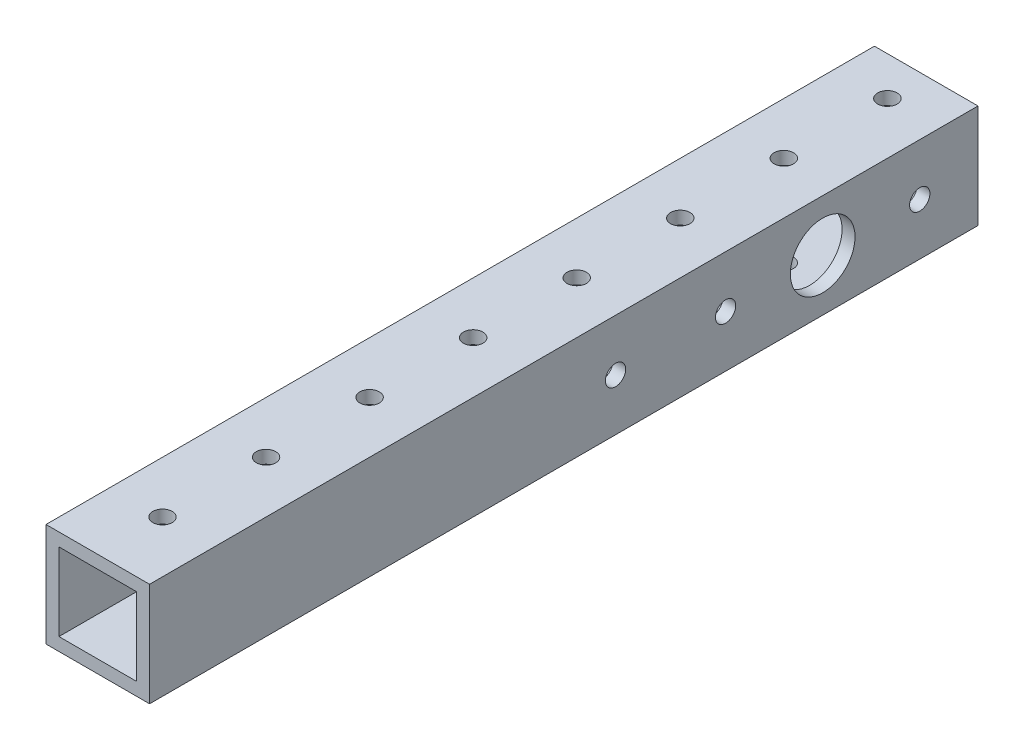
SolidWorks part; units mm, degrees
ref_plane "Front Plane" through (0, 0, 0) normal (0, 0, 1) x (1, 0, 0)
ref_plane "Top Plane" through (0, 0, 0) normal (0, 1, 0) x (1, 0, 0)
ref_plane "Right Plane" through (0, 0, 0) normal (1, 0, 0) x (0, 0, -1)
sketch "Sketch1" plane through (0, 0, 0) normal (0, 0, 1) x (1, 0, 0)
  line L1 (-12.7, -12.7) -> (12.7, -12.7)
  line L2 (-12.7, -12.7) -> (-12.7, 12.7)
  line L3 (-12.7, 12.7) -> (12.7, 12.7)
  line L4 (12.7, -12.7) -> (12.7, 12.7)
  line L5 (-12.7, -12.7) -> (12.7, 12.7) construction
  line L6 (-12.7, 12.7) -> (12.7, -12.7) construction
  line L7 (-9.525, -9.525) -> (9.525, -9.525)
  line L8 (-9.525, -9.525) -> (-9.525, 9.525)
  line L9 (-9.525, 9.525) -> (9.525, 9.525)
  line L10 (9.525, -9.525) -> (9.525, 9.525)
  line L11 (-9.525, -9.525) -> (9.525, 9.525) construction
  line L12 (-9.525, 9.525) -> (9.525, -9.525) construction
  point P0 (0, 0)
  point P6 (0, 0)
  dimension "D1" = 25.4
  dimension "D2" = 3.175
extrude "Boss-Extrude1" add sketch "Sketch1" along normal mid plane 203.2
sketch "Sketch2" plane through (12.7, 0, 0) normal (1, 0, 0) x (0, 0, -1)
  line L0 (-101.6, -12.7) -> (-101.6, 12.7) construction
  line L1 (15.8048, 0) -> (-207.087, 0) construction
  line L3 (87.3125, 0) -> (39.6875, 0) construction
  circle A0 centre (12.7, 0) radius 2.4892
  circle A1 centre (39.6875, 0) radius 2.4892
  circle A2 centre (63.5, 0) radius 7.9375
  circle A3 centre (87.3125, 0) radius 2.4892
  point P13 (63.5, 0)
  dimension "D2" = 4.9784
  dimension "D3" = 50.8
  dimension "D4" = 15.875
  dimension "D5" = 4.9784
  dimension "D1" = 114.3
  dimension "D6" = 47.625
extrude "Cut-Extrude1" cut sketch "Sketch2" against normal through all
sketch "Sketch3" plane through (0, 12.7, 0) normal (0, 1, 0) x (1, 0, 0)
  line L0 (0, 4.5044) -> (0, -99.9796) construction
  line L1 (12.7, 101.6) -> (-12.7, 101.6) construction
  circle A0 centre (0, 92.075) radius 2.3812
  dimension "D1" = 4.7625
  dimension "D2" = 9.525
extrude "Cut-Extrude2" cut sketch "Sketch3" against normal through all
pattern_linear "LPattern1" count 8 spacing 25.4 along (0, 0, 1) of "Cut-Extrude2"
sketch "Sketch4" plane through (-12.7, 0, 0) normal (-1, 0, 0) x (0, 0, 1)
  circle A0 centre (-87.3125, 0) radius 4.7625
  circle A1 centre (-39.6875, 0) radius 4.7625
  dimension "D1" = 9.525
extrude "Cut-Extrude3" cut sketch "Sketch4" against normal up to next
sketch "Sketch5" plane through (-9.525, 0, 0) normal (1, 0, 0) x (0, 0, -1)
  circle A0 centre (12.7, 0) radius 4.7625
  dimension "D1" = 9.525
extrude "Cut-Extrude4" cut sketch "Sketch5" against normal up to next
